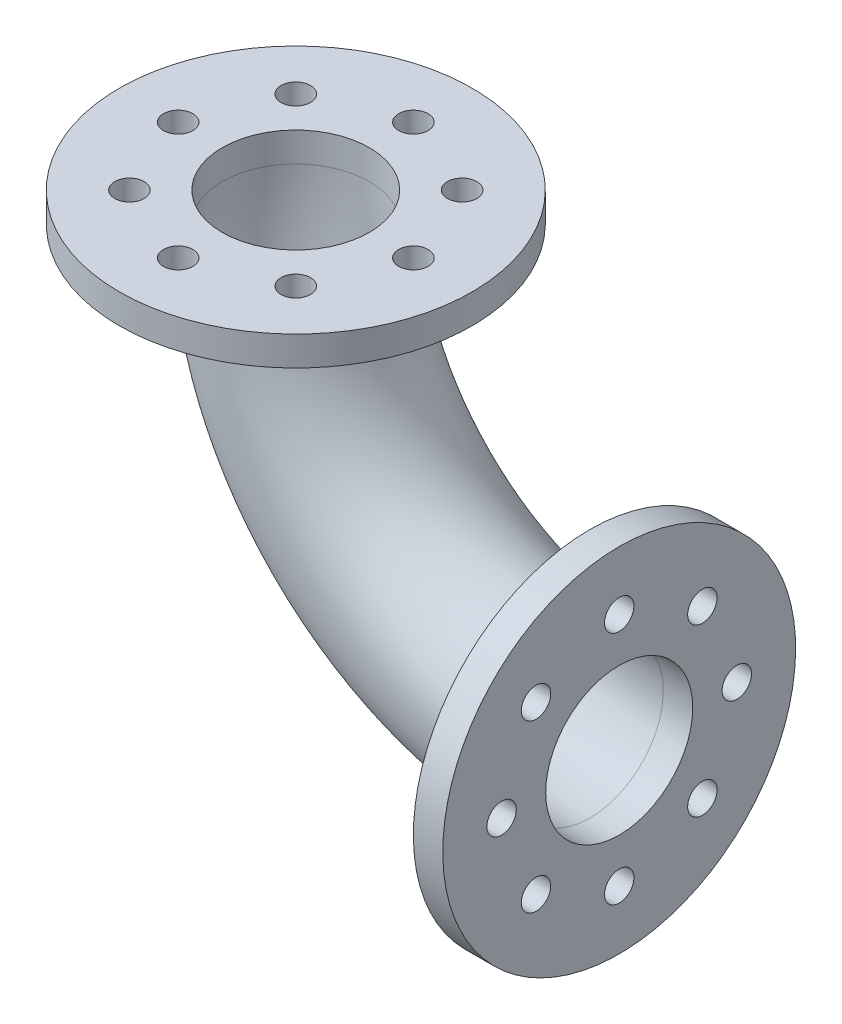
SolidWorks part; units mm, degrees
ref_plane "Front" through (0, 0, 0) normal (0, 0, 1) x (1, 0, 0)
ref_plane "Top" through (0, 0, 0) normal (0, 1, 0) x (1, 0, 0)
ref_plane "Right" through (0, 0, 0) normal (1, 0, 0) x (0, 0, -1)
sketch "Sketch1" plane through (0, 0, 0) normal (0, 0, 1) x (1, 0, 0)
  arc A0 (-50, 0) -> (0, -50) centre (0, 0) ccw
  dimension "D1" = 50
sketch "Sketch2" plane through (0, 0, 0) normal (0, 1, 0) x (1, 0, 0)
  circle A0 centre (-50, 0) radius 15
  circle A1 centre (-50, 0) radius 12.5
  dimension "D1" = 30
  dimension "D2" = 25
sweep "Sweep1" add profiles "Sketch2" path "Sketch1"
sketch "Sketch3" plane through (0, 0, 0) normal (0, 1, 0) x (-1, 0, 0)
  circle A0 centre (50, 0) radius 12.5 construction
  circle A1 centre (50, 0) radius 12.5
  circle A2 centre (50, 0) radius 30
  dimension "D1" = 60
extrude "Extrude2" add sketch "Sketch3" along normal blind 5
sketch "Sketch4" plane through (0, -13.6848, 2.0941) normal (1, 0, 0) x (0, 1, 0)
  circle A1 centre (-36.3152, -2.0941) radius 12.5
  circle A2 centre (-36.3152, -2.0941) radius 30
  circle A3 centre (-36.3152, -2.0941) radius 15 construction
  dimension "D1" = 60
extrude "Extrude3" add sketch "Sketch4" along normal blind 5
sketch "Sketch5" plane through (0, 5, 0) normal (0, 1, 0) x (-1, 0, 0)
  circle A1 centre (50, 0) radius 30 construction
  point P0 (70, 0)
  dimension "D1" = 20
other "Hole1"
sketch "Sketch6" plane through (0, 5, 0) normal (0, 1, 0) x (-1, 0, 0)
  circle A0 centre (70, 0) radius 2.5
  dimension "D1" = 5
pattern_circular "CirPattern1" count 8 over 360
sketch "Sketch7" plane through (0, 143.2655, 1.6299) normal (-1, 0, 0) x (0, -1, 0)
  circle A0 centre (173.2655, -1.6299) radius 2.5
  dimension "D1" = 5
  dimension "D2" = 20
other "Hole2"
pattern_circular "CirPattern2" count 8 over 360
